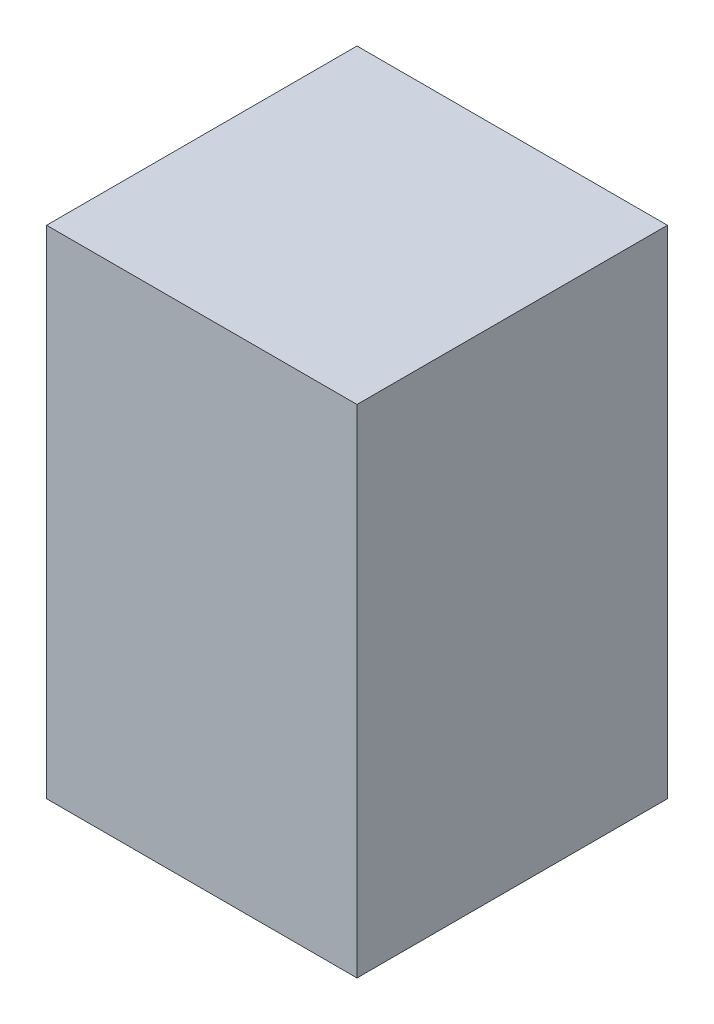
SolidWorks part; units mm, degrees
ref_plane "Front Plane" through (0, 0, 0) normal (0, 0, 1) x (1, 0, 0)
ref_plane "Top Plane" through (0, 0, 0) normal (0, 1, 0) x (1, 0, 0)
ref_plane "Right Plane" through (0, 0, 0) normal (1, 0, 0) x (0, 0, -1)
sketch "Sketch1" plane through (0, 0, 0) normal (0, 1, 0) x (1, 0, 0)
  line L1 (-15.875, -15.875) -> (15.875, -15.875)
  line L2 (-15.875, -15.875) -> (-15.875, 15.875)
  line L3 (-15.875, 15.875) -> (15.875, 15.875)
  line L4 (15.875, -15.875) -> (15.875, 15.875)
  line L5 (-15.875, -15.875) -> (15.875, 15.875) construction
  line L6 (-15.875, 15.875) -> (15.875, -15.875) construction
  point P0 (0, 0)
  dimension "D1" = 31.75
  dimension "D2" = 31.75
extrude "Boss-Extrude1" add sketch "Sketch1" along normal blind 50.8 contours L3 L4 L1 L2
sketch "Sketch2" plane through (0, 0, 0) normal (0, -1, 0) x (-1, 0, 0)
  circle A0 centre (0, 0) radius 4.7625
  dimension "D1" = 9.525
extrude "Cut-Extrude1" cut sketch "Sketch2" against normal blind 38.1
